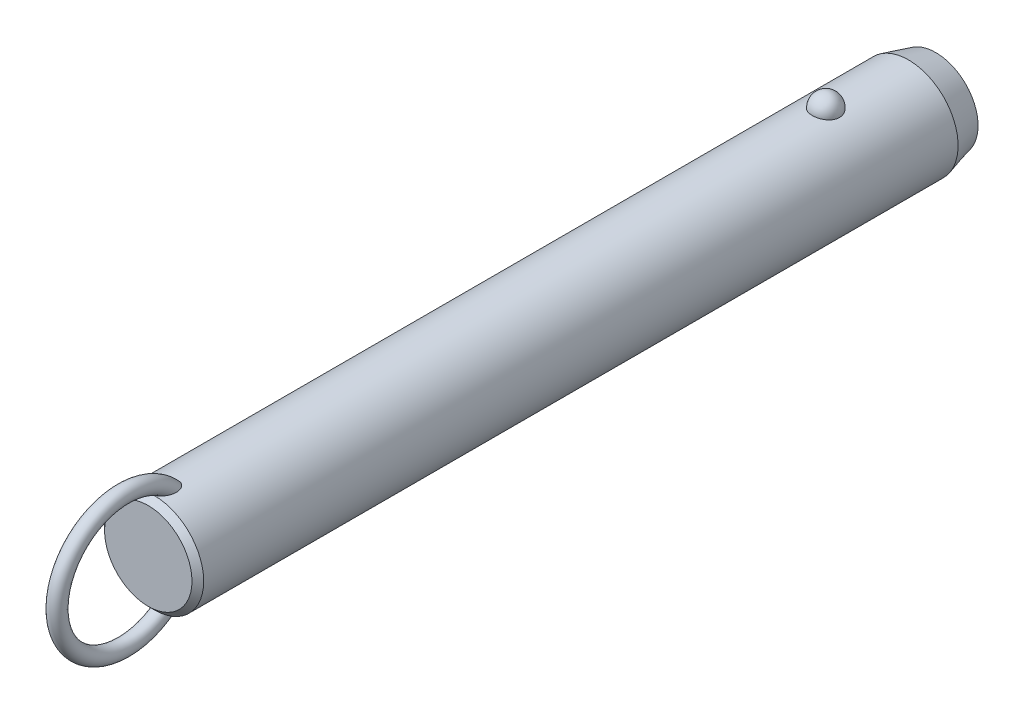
SolidWorks part; units mm, degrees
ref_plane "Front Plane" through (0, 0, 0) normal (0, 0, 1) x (1, 0, 0)
ref_plane "Top Plane" through (0, 0, 0) normal (0, 1, 0) x (1, 0, 0)
ref_plane "Right Plane" through (0, 0, 0) normal (1, 0, 0) x (0, 0, -1)
sketch "Sketch2" plane through (0, 0, 0) normal (0, 0, 1) x (1, 0, 0)
  circle A0 centre (0, 0) radius 12.7
  point P3 (0, 12.7)
  dimension "D1" = 25.4
extrude "Boss-Extrude1" add sketch "Sketch2" along normal blind 157.5
sketch "Sketch3" plane through (0, 0, 0) normal (0, 0, -1) x (-1, 0, 0)
  circle A0 centre (0, 0) radius 12.7
  dimension "D1" = 25.4
extrude "Boss-Extrude2" add sketch "Sketch3" along normal blind 31.7
chamfer "Chamfer1" distance 7 angle 15 1 edges at (-12.7, 0, -31.7)
sketch "Sketch12" plane through (0, 0, 0) normal (1, 0, 0) x (0, 0, -1)
  line L0 (-157.5, 12.7) -> (-157.5, -12.7) construction
  point P0 (-157.5, 0)
sketch "Sketch13" plane through (0, 0, 0) normal (1, 0, 0) x (0, 0, -1)
  circle A0 centre (-176.55, 0) radius 19.05
  point P2 (-157.5, 0)
  dimension "D1" = 38.1
sketch "Sketch14" plane through (0, 0, 0) normal (0, 1, 0) x (1, 0, 0)
  circle A0 centre (0, -159.5) radius 2
  point P2 (0, -157.5)
  dimension "D1" = 4
sweep "Sweep1" add profiles "Sketch14" path "Sketch13"
sketch "Sketch15" plane through (0, 0, 157.5) normal (0, 0, 1) x (1, 0, 0)
  circle A0 centre (0, 0) radius 12.7
  dimension "D1" = 25.4
extrude "Boss-Extrude3" add sketch "Sketch15" along normal blind 12.7
chamfer "Chamfer2" distance 1.5 angle 45 1 edges at (12.7, 0, 170.2)
sketch "Sketch18" plane through (0, 0, 0) normal (1, 0, 0) x (0, 0, -1)
  line L0 (24.7, 12.7) -> (-162.351, 12.7) construction
  line L1 (3.5, 16.2) -> (3.5, 9.2)
  line L2 (-162.351, -12.7) -> (24.7, -12.7) construction
  arc A0 (3.5, 16.2) -> (3.5, 9.2) centre (3.5, 12.7) ccw
  point P4 (0, 12.7)
  dimension "D1" = 28.9
revolve "Revolve1" add sketch "Sketch18" angle 360 about L1
